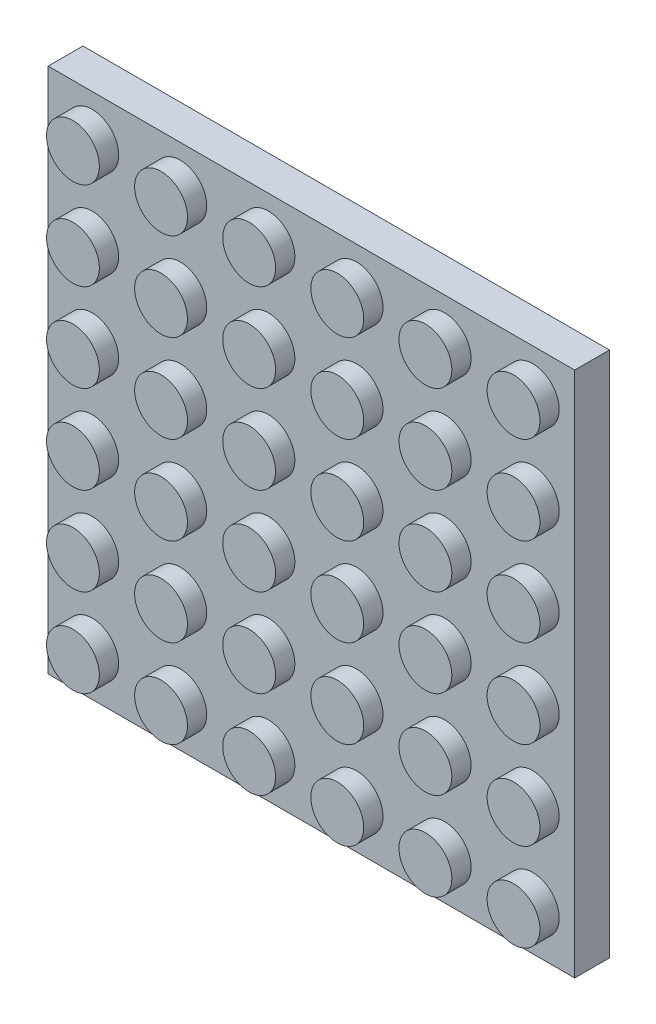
SolidWorks part; units mm, degrees
ref_plane "정면" through (0, 0, 0) normal (0, 0, 1) x (1, 0, 0)
ref_plane "윗면" through (0, 0, 0) normal (0, 1, 0) x (1, 0, 0)
ref_plane "우측면" through (0, 0, 0) normal (1, 0, 0) x (0, 0, -1)
sketch "스케치1" plane through (0.0073, -0.1313, 0) normal (0, 0, 1) x (1, 0, 0)
  line L1 (-8.5849, 7.9996) -> (39.2151, 7.9996)
  line L2 (-8.5849, 7.9996) -> (-8.5849, -39.8004)
  line L3 (-8.5849, -39.8004) -> (39.2151, -39.8004)
  line L4 (39.2151, 7.9996) -> (39.2151, -39.8004)
  dimension "D1" = 47.8
  dimension "D2" = 47.8
extrude "베이스돌출" add sketch "스케치1" against normal blind 3.16
sketch "스케치2" plane through (0, 0, 0) normal (0, 0, 1) x (1, 0, 0)
  line L0 (-8.5776, 7.8683) -> (-8.5776, -39.9317) construction
  line L1 (-8.5776, -39.9317) -> (39.2224, -39.9317) construction
  circle A0 centre (-4.5776, -35.9317) radius 2.4
  dimension "D1" = 4.8
  dimension "D2" = 4
  dimension "D3" = 4
extrude "보스-돌출1" add sketch "스케치2" along normal blind 1.75
pattern_linear "선형 패턴1" count 6 spacing 8 along (1, 0, 0) count 6 spacing 8 along (0, 1, 0) of "보스-돌출1"
sketch "스케치3" plane through (0, 0, -3.16) normal (0, 0, -1) x (-1, 0, 0)
  line L0 (8.5776, -39.9317) -> (-39.2224, -39.9317) construction
  line L1 (7.0776, -38.4317) -> (-37.7224, -38.4317)
  line L2 (7.0776, -38.4317) -> (7.0776, 6.3683)
  line L3 (7.0776, 6.3683) -> (-37.7224, 6.3683)
  line L4 (-37.7224, -38.4317) -> (-37.7224, 6.3683)
  line L5 (-39.2224, -39.9317) -> (-39.2224, 7.8683) construction
  line L6 (-39.2224, 7.8683) -> (8.5776, 7.8683) construction
  line L7 (8.5776, 7.8683) -> (8.5776, -39.9317) construction
  dimension "D1" = 1.5
  dimension "D2" = 1.5
  dimension "D3" = 1.5
  dimension "D4" = 1.5
extrude "컷-돌출1" cut sketch "스케치3" against normal blind 2
sketch "스케치4" plane through (0, 0, -1.16) normal (0, 0, -1) x (-1, 0, 0)
  line L1 (8.5776, 7.8683) -> (8.5776, -39.9317) construction
  line L2 (8.5776, -39.9317) -> (-39.2224, -39.9317) construction
  circle A0 centre (0.5776, -31.9317) radius 3.25
  circle A1 centre (0.5776, -31.9317) radius 2.5
  dimension "D1" = 8
  dimension "D2" = 8
  dimension "D3" = 5
  dimension "D4" = 6.5
extrude "보스-돌출2" add sketch "스케치4" along normal blind 2
sketch "스케치5" plane through (0, 0, -1.16) normal (0, 0, -1) x (-1, 0, 0)
  line L0 (-39.2224, -39.9317) -> (-39.2224, 7.8683) construction
  line L1 (8.5776, -39.9317) -> (-39.2224, -39.9317) construction
  circle A0 centre (-35.2224, -35.9317) radius 1.25
  dimension "D1" = 2.5
  dimension "D2" = 4
  dimension "D3" = 4
extrude "컷-돌출2" cut sketch "스케치5" against normal blind 2
pattern_linear "선형 패턴2" count 6 spacing 8 along (-1, 0, 0) count 10 spacing 8 along (0, 1, 0) of "컷-돌출2"
pattern_linear "선형 패턴3" count 5 spacing 8 along (0, 1, 0) count 5 spacing 8 along (1, 0, 0) of "보스-돌출2"
